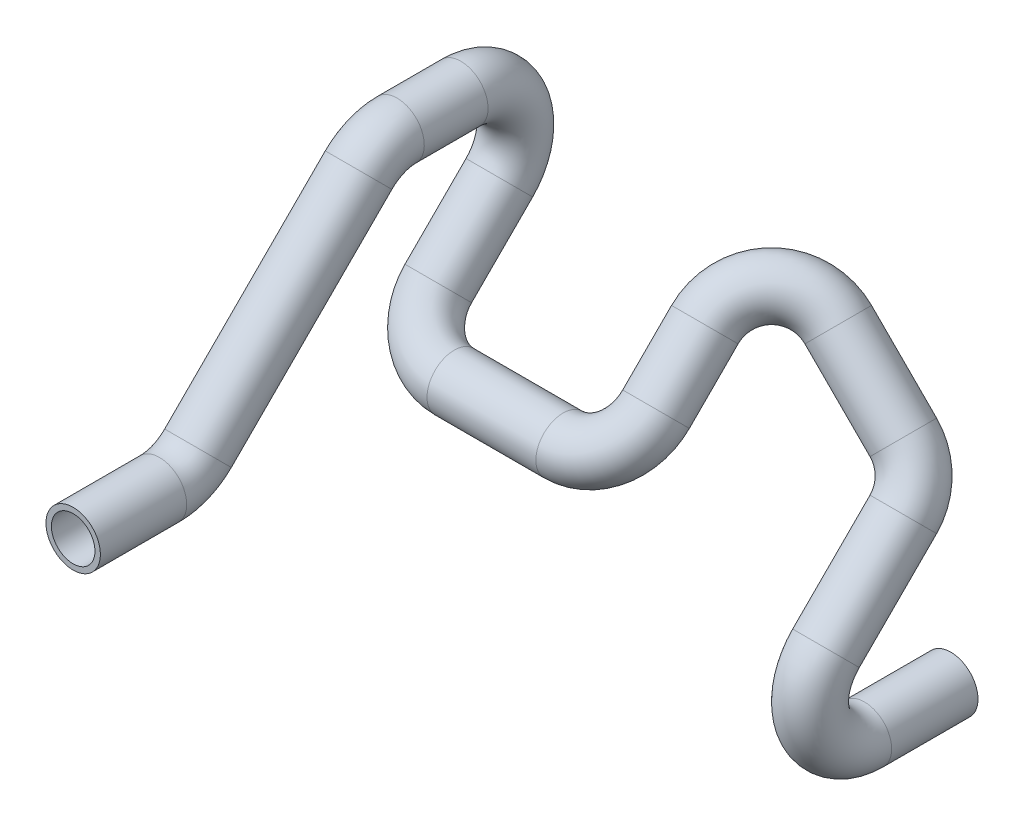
SolidWorks part; units mm, degrees
ref_plane "Front" through (0, 0, 0) normal (0, 0, 1) x (1, 0, 0)
ref_plane "Top" through (0, 0, 0) normal (0, 1, 0) x (1, 0, 0)
ref_plane "Right" through (0, 0, 0) normal (1, 0, 0) x (0, 0, -1)
sketch "Sketch1" plane through (0, 0, 0) normal (0, 1, 0) x (1, 0, 0)
  line L0 (0, 0) -> (-101.6, 0) construction
  line L1 (0, 0) -> (0, 101.6) construction
  dimension "D1" = 101.6
  dimension "D2" = 101.6
ref_plane "Plane1" through (0, 0, 0) normal (0.7071, 0.7071, 0) x (0, 0, -1)
ref_plane "Plane2" through (0, 0, 0) normal (0, 0.7071, 0.7071) x (-1, 0, 0)
sketch3d "SWEPT PATH"
  line L0 (-101.6, 0, 5.2605) -> (-101.6, 0, 25.4)
  line L1 (-101.6, 3.7197, -3.7197) -> (-101.6, 41.1815, -41.1815)
  line L2 (-101.6, 44.9013, -50.1618) -> (-101.6, 44.9013, -65.0408)
  line L3 (-101.6, 23.221, -74.021) -> (-101.6, 8.9803, -59.7803)
  line L4 (-88.9, 0, -50.8) -> (-63.5, 0, -50.8)
  line L5 (-50.8, 8.9803, -59.7803) -> (-50.8, 20.3668, -71.1668)
  line L6 (-35.2457, 20.3668, -86.721) -> (-20.0637, 5.1848, -86.721)
  line L7 (-14.879, -5.1848, -81.5363) -> (-14.879, -23.221, -63.5)
  line L8 (-14.879, -44.9013, -72.4803) -> (-14.879, -44.9013, -92.6197)
  arc A0 (-101.6, 0, 5.2605) -> (-101.6, 3.7197, -3.7197) centre (-101.6, 12.7, 5.2605) ccw
  arc A1 (-101.6, 41.1815, -41.1815) -> (-101.6, 44.9013, -50.1618) centre (-101.6, 32.2013, -50.1618) ccw
  arc A2 (-101.6, 44.9013, -65.0408) -> (-101.6, 23.221, -74.021) centre (-101.6, 32.2013, -65.0408) ccw
  arc A3 (-101.6, 8.9803, -59.7803) -> (-88.9, 0, -50.8) centre (-88.9, 8.9803, -59.7803) ccw
  arc A4 (-63.5, 0, -50.8) -> (-50.8, 8.9803, -59.7803) centre (-63.5, 8.9803, -59.7803) ccw
  arc A5 (-50.8, 20.3668, -71.1668) -> (-35.2457, 20.3668, -86.721) centre (-40.4305, 15.182, -76.3515) ccw
  arc A6 (-20.0637, 5.1848, -86.721) -> (-14.879, -5.1848, -81.5363) centre (-25.2485, 0, -76.3515) ccw
  arc A7 (-14.879, -23.221, -63.5) -> (-14.879, -44.9013, -72.4803) centre (-14.879, -32.2013, -72.4803) ccw
  point P13 (-101.6, 0, 0)
  point P14 (-88.9, 12.7, 5.2605)
  point P17 (-101.6, 44.9013, -44.9013)
  point P18 (-114.3, 32.2013, -50.1618)
  point P21 (-101.6, 44.9013, -95.7013)
  point P22 (-114.3, 32.2013, -65.0408)
  point P25 (-101.6, 0, -50.8)
  point P26 (-88.9, 17.9605, -50.8)
  point P29 (-50.8, 0, -50.8)
  point P30 (-63.5, 17.9605, -50.8)
  point P33 (-50.8, 35.921, -86.721)
  point P34 (-47.7628, 7.8497, -83.6839)
  point P37 (-14.879, 0, -86.721)
  point P38 (-32.5808, -7.3323, -83.6839)
  point P41 (-14.879, -44.9013, -41.8197)
  point P42 (-2.179, -32.2013, -72.4803)
  dimension "D10" = 12.7
  dimension "D11" = 12.7
  dimension "D12" = 12.7
  dimension "D13" = 12.7
  dimension "D14" = 12.7
  dimension "D15" = 12.7
  dimension "D16" = 12.7
  dimension "D17" = 12.7
  dimension "D1" = 25.4
  dimension "D2" = 63.5
  dimension "D3" = 50.8
  dimension "D4" = 63.5
  dimension "D5" = 50.8
  dimension "D6" = 50.8
  dimension "D7" = 63.5
  dimension "D8" = 50.8
  dimension "D9" = 50.8
ref_plane "Plane3" through (-101.6, 0, 25.4) normal (0, 0, 1) x (1, 0, 0)
sketch "Sketch2" plane through (-101.6, 0, 25.4) normal (0, 0, 1) x (1, 0, 0)
  circle A0 centre (0, 0) radius 5.08
  circle A1 centre (0, 0) radius 6.35
  dimension "D1" = 10.16
  dimension "D2" = 12.7
sweep "Sweep1" add profiles "Sketch2" path "SWEPT PATH"
